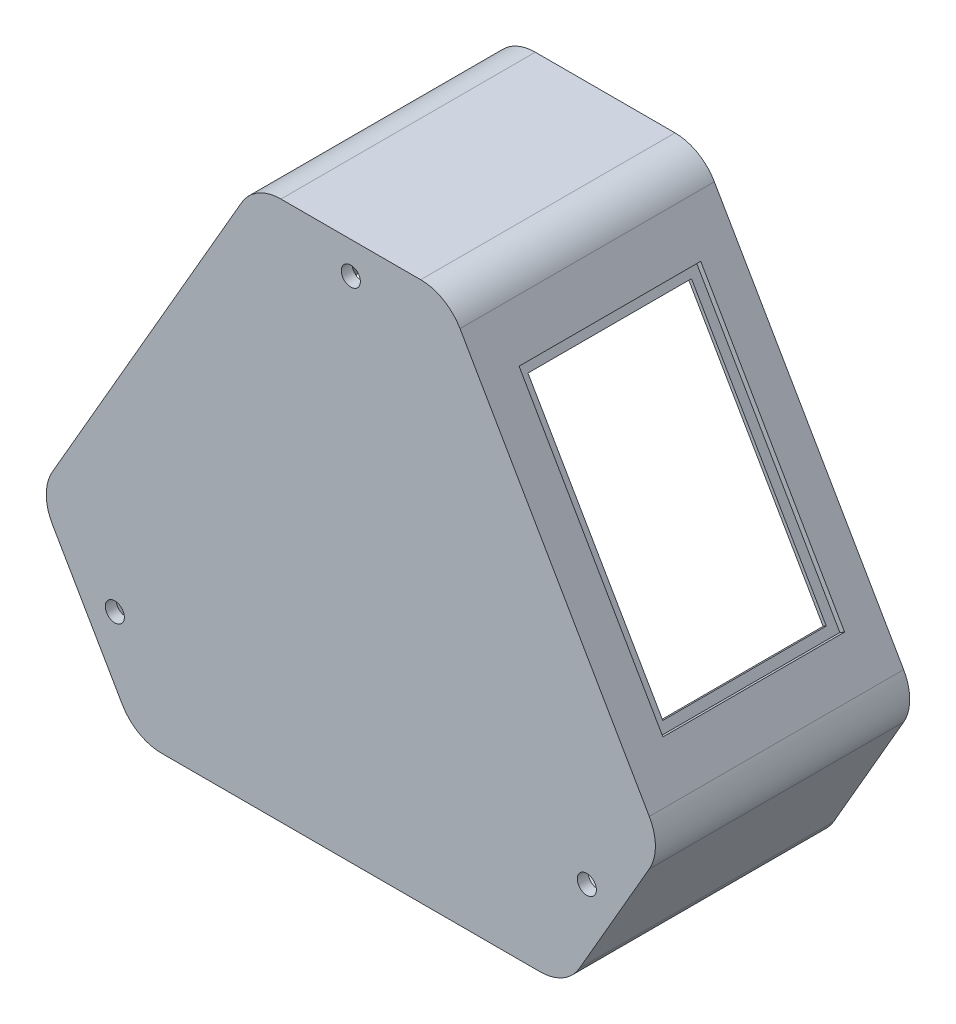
SolidWorks part; units mm, degrees
ref_plane "Front Plane" through (0, 0, 0) normal (0, 0, 1) x (1, 0, 0)
ref_plane "Top Plane" through (0, 0, 0) normal (0, 1, 0) x (1, 0, 0)
ref_plane "Right Plane" through (0, 0, 0) normal (1, 0, 0) x (0, 0, -1)
sketch "Sketch1" plane through (0, 0, 0) normal (0, 0, 1) x (1, 0, 0)
  line L6 (0, -124.5513) -> (0, 162.5) construction
  line L7 (-100.3646, 57.9455) -> (140.7291, -81.25) construction
  line L8 (107.8646, 62.2756) -> (-140.7291, -81.25) construction
  line L9 (-50, 162.5) -> (50, 162.5)
  line L10 (-115.7291, -124.5513) -> (115.7291, -124.5513)
  line L11 (165.7291, -37.9487) -> (115.7291, -124.5513)
  line L12 (50, 162.5) -> (165.7291, -37.9487)
  line L13 (-50, 162.5) -> (-165.7291, -37.9487)
  line L14 (-165.7291, -37.9487) -> (-115.7291, -124.5513)
  line L15 (-32.6795, 132.5) -> (-131.0881, -37.9487)
  line L16 (-131.0881, -37.9487) -> (-98.4086, -94.5513)
  line L17 (-98.4086, -94.5513) -> (98.4086, -94.5513)
  line L18 (131.0881, -37.9487) -> (98.4086, -94.5513)
  line L19 (32.6795, 132.5) -> (131.0881, -37.9487)
  line L20 (-32.6795, 132.5) -> (32.6795, 132.5)
  circle A0 centre (0, 0) radius 150 construction
  circle A1 centre (-30, 146.9694) radius 1.5
  circle A2 centre (30, 146.9694) radius 1.5
  circle A3 centre (112.2792, -99.4655) radius 1.5
  circle A4 centre (142.2792, -47.5039) radius 1.5
  circle A5 centre (-142.2792, -47.5039) radius 1.5
  circle A6 centre (-112.2792, -99.4655) radius 1.5
  point P6 (0, 0)
  point P15 (140.7291, -81.25)
  point P31 (0, 0)
  dimension "D4" = 162.5
  dimension "D5" = 3
  dimension "D6" = 30
  dimension "D1" = 60
  dimension "D2" = 60
  dimension "D8" = 50
  dimension "D9" = 30
  dimension "D7" = 3
extrude "Boss-Extrude1" add sketch "Sketch1" along normal blind 6 contours L20 L15 L16 L17 L18 L19 | L13 L14 L10 L11 L12 L9 A6 A5 A4 A3 A2 A1 L15 L20 L19 L18 L17 L16 | A1 | A2 | A4 | A3 | A6 | A5
sketch "Sketch2" plane through (0, 0, 6) normal (0, 0, 1) x (1, 0, 0)
  line L0 (0, 0) -> (0, 150) construction
  circle A0 centre (0, 150) radius 5.25
  circle A1 centre (129.9038, -75) radius 5.25
  circle A2 centre (-129.9038, -75) radius 5.25
  point P10 (0, 0)
  dimension "D1" = 150
  dimension "D2" = 10.5
  dimension "D3" = 3
extrude "Cut-Extrude1" cut sketch "Sketch2" against normal through all
fillet "Fillet1" radius 20 6 edges at (-50, 162.5, 3) (50, 162.5, 3) (165.7291, -37.9487, 3) (115.7291, -124.5513, 3) (-165.7291, -37.9487, 3) (-115.7291, -124.5513, 3)
sketch "Sketch3" plane through (0, 0, 6) normal (0, 0, 1) x (1, 0, 0)
  line L0 (38.453, 167.5) -> (-38.453, 167.5)
  line L1 (-60.1036, 155) -> (-164.2858, -25.4487)
  line L2 (-164.2858, -50.4487) -> (-125.8328, -117.0513)
  line L3 (-104.1821, -129.5513) -> (104.1821, -129.5513)
  line L4 (125.8328, -117.0513) -> (164.2858, -50.4487)
  line L5 (164.2858, -25.4487) -> (60.1036, 155)
  line L6 (38.453, 162.5) -> (-38.453, 162.5)
  line L7 (-55.7735, 152.5) -> (-159.9556, -27.9487)
  line L8 (-159.9556, -47.9487) -> (-121.5026, -114.5513)
  line L9 (-104.1821, -124.5513) -> (104.1821, -124.5513)
  line L10 (121.5026, -114.5513) -> (159.9556, -47.9487)
  line L11 (159.9556, -27.9487) -> (55.7735, 152.5)
  line L12 (38.453, 162.5) -> (-38.453, 162.5)
  line L13 (-55.7735, 152.5) -> (-159.9556, -27.9487)
  line L14 (-159.9556, -47.9487) -> (-121.5026, -114.5513)
  line L15 (-104.1821, -124.5513) -> (104.1821, -124.5513)
  line L16 (121.5026, -114.5513) -> (159.9556, -47.9487)
  line L17 (159.9556, -27.9487) -> (55.7735, 152.5)
  arc A0 (-38.453, 167.5) -> (-60.1036, 155) centre (-38.453, 142.5) ccw
  arc A1 (-164.2858, -25.4487) -> (-164.2858, -50.4487) centre (-142.6351, -37.9487) ccw
  arc A2 (-125.8328, -117.0513) -> (-104.1821, -129.5513) centre (-104.1821, -104.5513) ccw
  arc A3 (104.1821, -129.5513) -> (125.8328, -117.0513) centre (104.1821, -104.5513) ccw
  arc A4 (164.2858, -50.4487) -> (164.2858, -25.4487) centre (142.6351, -37.9487) ccw
  arc A5 (60.1036, 155) -> (38.453, 167.5) centre (38.453, 142.5) ccw
  arc A6 (-38.453, 162.5) -> (-55.7735, 152.5) centre (-38.453, 142.5) ccw
  arc A7 (-159.9556, -27.9487) -> (-159.9556, -47.9487) centre (-142.6351, -37.9487) ccw
  arc A8 (-121.5026, -114.5513) -> (-104.1821, -124.5513) centre (-104.1821, -104.5513) ccw
  arc A9 (104.1821, -124.5513) -> (121.5026, -114.5513) centre (104.1821, -104.5513) ccw
  arc A10 (159.9556, -47.9487) -> (159.9556, -27.9487) centre (142.6351, -37.9487) ccw
  arc A11 (55.7735, 152.5) -> (38.453, 162.5) centre (38.453, 142.5) ccw
  arc A12 (-38.453, 162.5) -> (-55.7735, 152.5) centre (-38.453, 142.5) ccw
  arc A13 (-159.9556, -27.9487) -> (-159.9556, -47.9487) centre (-142.6351, -37.9487) ccw
  arc A14 (-121.5026, -114.5513) -> (-104.1821, -124.5513) centre (-104.1821, -104.5513) ccw
  arc A15 (104.1821, -124.5513) -> (121.5026, -114.5513) centre (104.1821, -104.5513) ccw
  arc A16 (159.9556, -47.9487) -> (159.9556, -27.9487) centre (142.6351, -37.9487) ccw
  arc A17 (55.7735, 152.5) -> (38.453, 162.5) centre (38.453, 142.5) ccw
  dimension "D1" = 0
  dimension "D2" = 5
extrude "Boss-Extrude2" add sketch "Sketch3" against normal blind 140
sketch "Sketch5" plane through (-112.1947, 64.7756, 0) normal (-0.866, 0.5, 0) x (0, 0, 1)
  line L0 (-134, 0) -> (6, 0) construction
  line L1 (-134, 104.1821) -> (-134, -104.1821) construction
  line L2 (6, 104.1821) -> (6, -104.1821) construction
  line L4 (-114, -79.18) -> (-14, -79.18)
  line L5 (-114, -79.18) -> (-114, 79.18)
  line L6 (-114, 79.18) -> (-14, 79.18)
  line L7 (-14, -79.18) -> (-14, 79.18)
  line L8 (-114, -79.18) -> (-14, 79.18) construction
  line L9 (-114, 79.18) -> (-14, -79.18) construction
  line L10 (-19, -74.18) -> (-109, -74.18)
  line L11 (-19, -74.18) -> (-19, 74.18)
  line L12 (-19, 74.18) -> (-109, 74.18)
  line L13 (-109, -74.18) -> (-109, 74.18)
  line L14 (-19, -74.18) -> (-109, 74.18) construction
  line L15 (-19, 74.18) -> (-109, -74.18) construction
  point P6 (-64, 0)
  point P11 (-64, 0)
  dimension "D1" = 158.36
  dimension "D2" = 100
  dimension "D3" = 5
  dimension "D4" = 5
extrude "Cut-Extrude2" cut sketch "Sketch5" against normal blind 3
sketch "Sketch6" plane through (-112.1947, 64.7756, 0) normal (-0.866, 0.5, 0) x (0, 0, 1)
  line L0 (0, 0) -> (-114, 0) construction
  line L1 (-114, 79.18) -> (-114, -79.18) construction
  line L3 (-109, 74.18) -> (-19, 74.18)
  line L4 (-109, 74.18) -> (-109, -74.18)
  line L5 (-109, -74.18) -> (-19, -74.18)
  line L6 (-19, 74.18) -> (-19, -74.18)
extrude "Cut-Extrude3" cut sketch "Sketch6" against normal blind 5
sketch "Sketch7" plane through (112.1947, 64.7756, 0) normal (0.866, 0.5, 0) x (0, 0, -1)
  line L0 (-6, 0) -> (134, 0) construction
  line L2 (-6, -104.1821) -> (-6, 104.1821) construction
  line L3 (134, -104.1821) -> (134, 104.1821) construction
  line L4 (19, -74.18) -> (109, -74.18)
  line L5 (14, -79.18) -> (114, -79.18)
  line L6 (14, -79.18) -> (14, 79.18)
  line L7 (14, 79.18) -> (114, 79.18)
  line L8 (114, -79.18) -> (114, 79.18)
  line L9 (14, -79.18) -> (114, 79.18) construction
  line L10 (14, 79.18) -> (114, -79.18) construction
  line L11 (19, -74.18) -> (19, 74.18)
  line L12 (19, 74.18) -> (109, 74.18)
  line L13 (109, -74.18) -> (109, 74.18)
  line L14 (19, -74.18) -> (109, 74.18) construction
  line L15 (19, 74.18) -> (109, -74.18) construction
  point P2 (64, 0)
  point P7 (64, 0)
  dimension "D1" = 100
  dimension "D2" = 158.36
  dimension "D3" = 5
  dimension "D4" = 5
extrude "Cut-Extrude4" cut sketch "Sketch7" against normal blind 3
sketch "Sketch8" plane through (112.1947, 64.7756, 0) normal (0.866, 0.5, 0) x (0, 0, -1)
  line L0 (19, 0) -> (109, 0) construction
  line L1 (19, 74.18) -> (19, -74.18) construction
  line L2 (109, -74.18) -> (109, 74.18) construction
  line L3 (109, -74.18) -> (109, 74.18) construction
  line L4 (19, -74.18) -> (109, -74.18)
  line L5 (19, -74.18) -> (19, 74.18)
  line L6 (19, 74.18) -> (109, 74.18)
  line L7 (109, -74.18) -> (109, 74.18)
  line L8 (19, -74.18) -> (109, 74.18) construction
  line L9 (19, 74.18) -> (109, -74.18) construction
  point P6 (64, 0)
extrude "Cut-Extrude5" cut sketch "Sketch8" against normal blind 23
